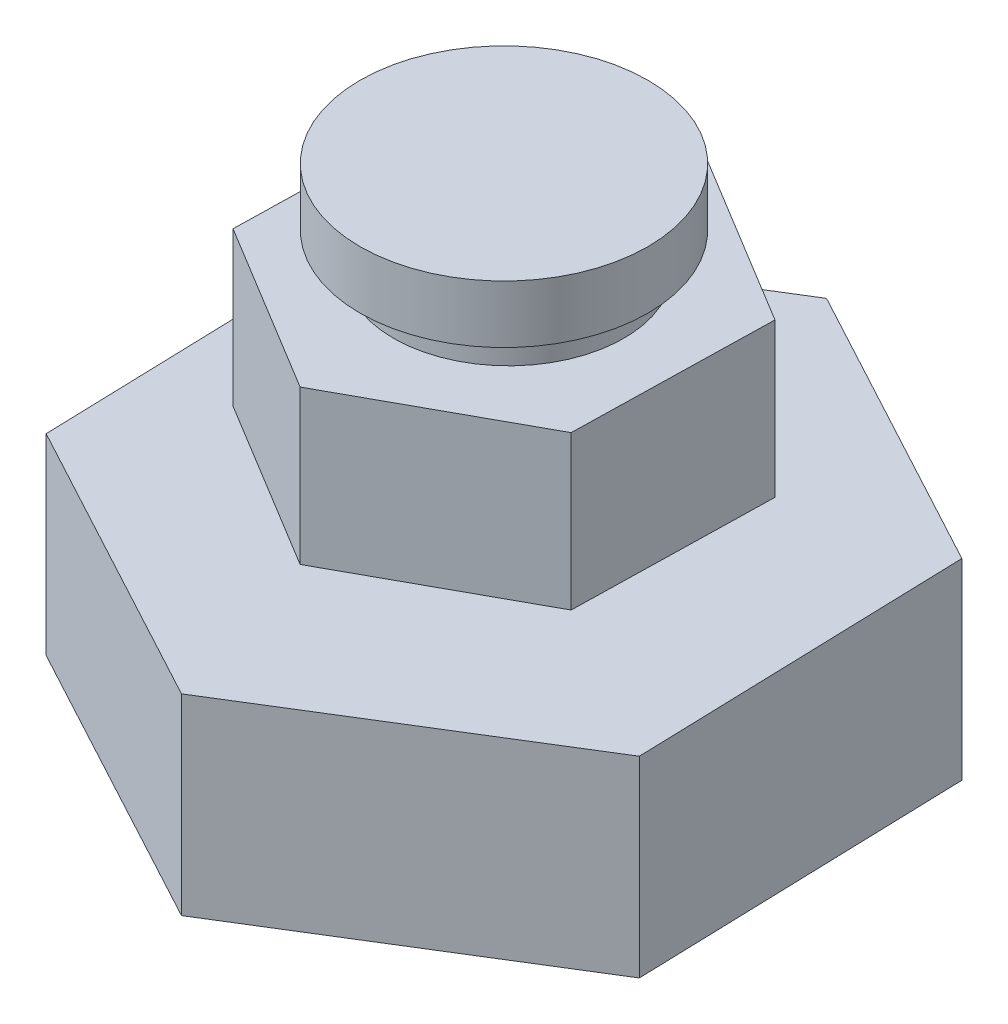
SolidWorks part; units mm, degrees
other "Bolt"
other "Top"
other "Base"
ref_plane "Front Plane" through (0, 0, 0) normal (0, 0, 1) x (1, 0, 0)
ref_plane "Top Plane" through (0, 0, 0) normal (0, 1, 0) x (1, 0, 0)
ref_plane "Right Plane" through (0, 0, 0) normal (1, 0, 0) x (0, 0, -1)
sketch "Sketch1" plane through (0, 0, 0) normal (0, 1, 0) x (1, 0, 0)
  line L1 (15.2529, -8.2067) -> (14.7336, 9.106)
  line L2 (14.7336, 9.106) -> (-0.5192, 17.3127)
  line L3 (-0.5192, 17.3127) -> (-15.2529, 8.2067)
  line L4 (-15.2529, 8.2067) -> (-14.7336, -9.106)
  line L5 (-14.7336, -9.106) -> (0.5192, -17.3127)
  line L6 (0.5192, -17.3127) -> (15.2529, -8.2067)
  circle A0 centre (0, 0) radius 15 construction
  dimension "D1" = 30
extrude "Boss-Extrude1" add sketch "Sketch1" along normal blind 10
ref_plane "Plane1" through (0, 25, 0) normal (0, 1, 0) x (1, 0, 0)
sketch "Sketch2" plane through (0, 25, 0) normal (0, 1, 0) x (1, 0, 0)
  circle A0 centre (0, 0) radius 7.5
  dimension "D1" = 15
extrude "Boss-Extrude2" add sketch "Sketch2" against normal blind 3 separate body
sketch "Sketch3" plane through (0, 22, 0) normal (0, -1, 0) x (1, 0, 0)
  line L1 (-8.1847, -6.4039) -> (1.4536, -10.2901) construction
  line L2 (1.4536, -10.2901) -> (9.6383, -3.8862) construction
  line L3 (9.6383, -3.8862) -> (8.1847, 6.4039) construction
  line L4 (8.1847, 6.4039) -> (-1.4536, 10.2901) construction
  line L5 (-1.4536, 10.2901) -> (-9.6383, 3.8862) construction
  line L6 (-9.6383, 3.8862) -> (-8.1847, -6.4039) construction
  circle A0 centre (0, 0) radius 9 construction
  circle A1 centre (0.0073, -0.2365) radius 6
  circle A2 centre (0.0073, -0.2365) radius 4.5
  circle A3 centre (0, 0) radius 3
  dimension "D2" = 12
  dimension "D4" = 6
  dimension "D1" = 18
  dimension "D3" = 1.5
extrude "Boss-Extrude3" add sketch "Sketch3" along normal blind 2 contours A1 | A2 | A3
sketch "Sketch6" plane through (0, 20, 0) normal (0, -1, 0) x (1, 0, 0)
  circle A1 centre (0, 0) radius 3
  circle A2 centre (0, 0) radius 3
  dimension "D1" = 0
extrude "Boss-Extrude4" add sketch "Sketch6" along normal blind 4
chamfer "Chamfer1" distance 1 angle 45 1 edges at (0.0073, 20, -4.7365)
ref_plane "Plane2" through (0, 20, 0) normal (0, -1, 0) x (-1, 0, 0)
sketch "Sketch7" plane through (0, 20, 0) normal (0, -1, 0) x (-1, 0, 0)
  line L1 (-8.8853, -5.39) -> (0.2252, -10.3899)
  line L2 (0.2252, -10.3899) -> (9.1105, -4.9999)
  line L3 (9.1105, -4.9999) -> (8.8853, 5.39)
  line L4 (8.8853, 5.39) -> (-0.2252, 10.3899)
  line L5 (-0.2252, 10.3899) -> (-9.1105, 4.9999)
  line L6 (-9.1105, 4.9999) -> (-8.8853, -5.39)
  circle A0 centre (0, 0) radius 3 construction
  circle A1 centre (0, 0) radius 3
  circle A2 centre (0, 0) radius 9 construction
  circle A3 centre (0, 0) radius 3.05
  dimension "D2" = 6.1
  dimension "D1" = 18
extrude "Boss-Extrude5" add sketch "Sketch7" along normal blind 8 separate body contours L5 L6 L1 L2 L3 L4 A3
sketch "Sketch8" plane through (0, 12, 0) normal (0, -1, 0) x (1, 0, 0)
  circle A0 centre (0, 0) radius 6
  dimension "D1" = 12
extrude "Boss-Extrude6" add sketch "Sketch8" along normal blind 10
thread "Thread1" pitch 1.5 start angle 0, offset 1, length 0, pitch 1.5, diameter 12
ref_plane "Plane3" through (6, 1, 0) normal (0, 0, 1) x (1, 0, 0)
sketch "Thread Profile1" plane through (6, 1, 0) normal (0, 0, 1) x (1, 0, 0)
  line L0 (0, 0) -> (0, 1.5) construction
  line L11 (0, 0) -> (0, 1.3125)
  line L12 (0, 1.3125) -> (-0.8119, 0.8437)
  line L13 (-0.8119, 0.8437) -> (-0.8119, 0.4687)
  line L15 (-0.8119, 0.4687) -> (0, 0)
  line L17 (-0.8119, 0.6562) -> (0, 0.6562) construction
  point P2 (0, 0)
  dimension "Pitch" = 1.5
  dimension "Profile_Angle" = 60
  dimension "Profile_Land" = 0.375
  dimension "Profile_Height" = 0.8119
